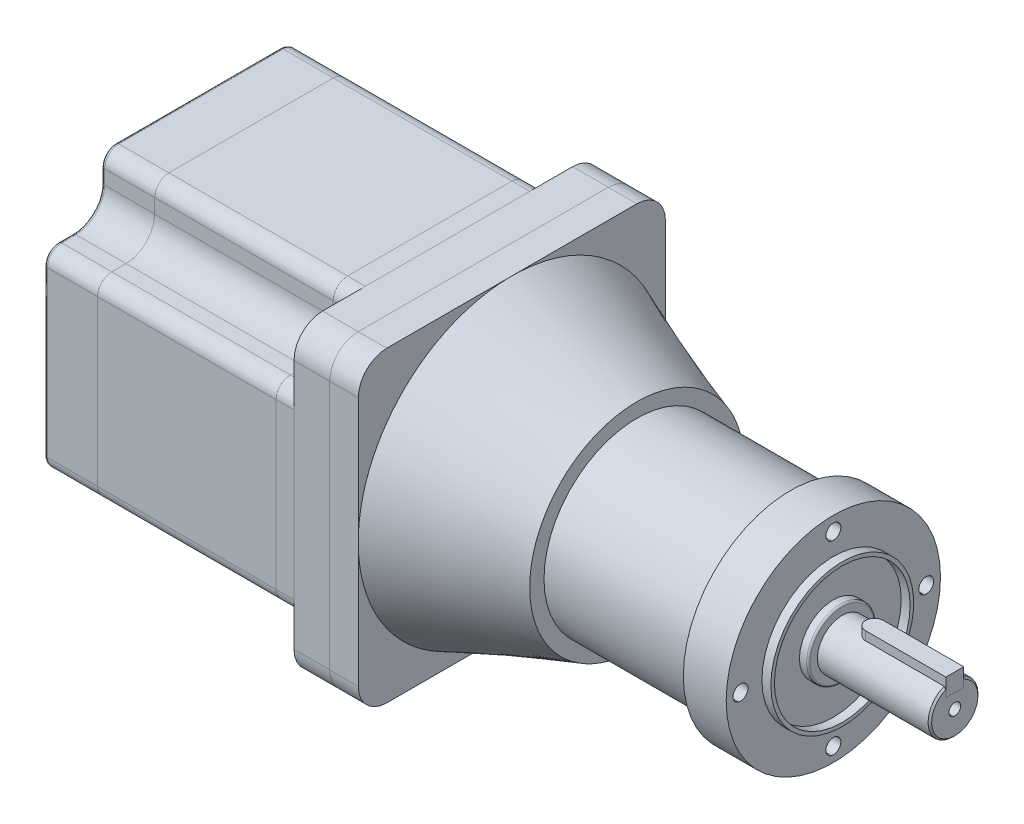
SolidWorks part; units mm, degrees
ref_plane "前视基准面" through (0, 0, 0) normal (0, 0, 1) x (1, 0, 0)
ref_plane "上视基准面" through (0, 0, 0) normal (0, 1, 0) x (1, 0, 0)
ref_plane "右视基准面" through (0, 0, 0) normal (1, 0, 0) x (0, 0, -1)
sketch "草图1" plane through (0, 0, 0) normal (1, 0, 0) x (0, 0, -1)
  line L1 (-35, -43) -> (35, -43)
  line L2 (-43, -35) -> (-43, 35)
  line L3 (-35, 43) -> (35, 43)
  line L4 (43, -35) -> (43, 35)
  line L5 (-43, -43) -> (43, 43) construction
  line L6 (-43, 43) -> (43, -43) construction
  arc A0 (-35, -43) -> (-43, -35) centre (-35, -35) cw
  arc A1 (43, -35) -> (35, -43) centre (35, -35) cw
  arc A2 (-35, 43) -> (-43, 35) centre (-35, 35) ccw
  arc A3 (35, 43) -> (43, 35) centre (35, 35) cw
  point P0 (0, 0)
  dimension "D1" = 8
extrude "凸台-拉伸1" add sketch "草图1" against normal blind 10
sketch "草图2" plane through (-10, 0, 0) normal (-1, 0, 0) x (0, 0, 1)
  line L0 (-35, 43) -> (35, 43) construction
  line L1 (-35, -43) -> (35, -43)
  line L2 (-43, -35) -> (-43, 35)
  line L3 (-35, 43) -> (35, 43)
  line L4 (43, -35) -> (43, 35)
  line L5 (-43, -43) -> (43, 43) construction
  line L6 (-43, 43) -> (43, -43) construction
  arc A0 (-43, -35) -> (-35, -43) centre (-35, -35) ccw
  arc A1 (35, -43) -> (43, -35) centre (35, -35) ccw
  arc A2 (43, 35) -> (35, 43) centre (35, 35) ccw
  arc A3 (-43, 35) -> (-35, 43) centre (-35, 35) cw
  point P0 (0, 0)
  dimension "D1" = 8
extrude "凸台-拉伸2" add sketch "草图2" along normal blind 5 separate body
sketch "草图3" plane through (-15, 0, 0) normal (-1, 0, 0) x (0, 0, 1)
  line L0 (35, 43) -> (-35, 43) construction
  line L1 (-35, -43) -> (35, -43)
  line L2 (-43, -35) -> (-43, 35)
  line L3 (-35, 43) -> (35, 43)
  line L4 (43, -35) -> (43, 35)
  line L5 (-43, -43) -> (43, 43) construction
  line L6 (-43, 43) -> (43, -43) construction
  arc A0 (-43, -35) -> (-35, -43) centre (-35, -35) ccw
  arc A1 (35, -43) -> (43, -35) centre (35, -35) ccw
  arc A2 (43, 35) -> (35, 43) centre (35, 35) ccw
  arc A3 (-43, 35) -> (-35, 43) centre (-35, 35) cw
  point P0 (0, 0)
  dimension "D1" = 8
extrude "凸台-拉伸3" add sketch "草图3" along normal blind 50 separate body
sketch "草图4" plane through (-65, 0, 0) normal (-1, 0, 0) x (0, 0, 1)
  line L0 (35, 43) -> (-35, 43) construction
  line L1 (-35, -43) -> (35, -43)
  line L2 (-43, -35) -> (-43, 35)
  line L3 (-35, 43) -> (35, 43)
  line L4 (43, -35) -> (43, 35)
  line L5 (-43, -43) -> (43, 43) construction
  line L6 (-43, 43) -> (43, -43) construction
  arc A0 (-43, -35) -> (-35, -43) centre (-35, -35) ccw
  arc A1 (35, -43) -> (43, -35) centre (35, -35) ccw
  arc A2 (43, 35) -> (35, 43) centre (35, 35) ccw
  arc A3 (-43, 35) -> (-35, 43) centre (-35, 35) cw
  point P0 (0, 0)
  dimension "D1" = 8
extrude "凸台-拉伸4" add sketch "草图4" along normal blind 15 separate body
sketch "草图5" plane through (-80, 0, 0) normal (-1, 0, 0) x (0, 0, 1)
  line L0 (-35, -27) -> (-39, -27)
  line L1 (-43, 35) -> (-43, -35) construction
  line L3 (-39, 27) -> (-35, 27)
  line L4 (-43, -35) -> (-43, -23)
  line L5 (-27, 35) -> (-27, 39)
  line L6 (35, 43) -> (-35, 43) construction
  line L8 (27, 39) -> (27, 35)
  line L9 (-35, -43) -> (-23, -43)
  line L10 (35, 27) -> (39, 27)
  line L12 (43, -35) -> (43, 35) construction
  line L13 (39, -27) -> (35, -27)
  line L14 (35, -43) -> (23, -43)
  line L15 (27, -35) -> (27, -39)
  line L16 (-35, -43) -> (35, -43) construction
  line L18 (-27, -39) -> (-27, -35)
  line L19 (43, -35) -> (43, -23)
  line L20 (43, 35) -> (43, 23)
  line L21 (35, 43) -> (23, 43)
  line L22 (-35, 43) -> (-23, 43)
  line L23 (-43, 35) -> (-43, 23)
  arc A0 (-35, 43) -> (-43, 35) centre (-35, 35) ccw
  arc A1 (27, 35) -> (35, 27) centre (35, 35) ccw
  arc A2 (35, -27) -> (27, -35) centre (35, -35) ccw
  arc A3 (-43, -35) -> (-35, -43) centre (-35, -35) ccw
  arc A4 (-39, -27) -> (-43, -23) centre (-39, -23) cw
  arc A5 (-43, 23) -> (-39, 27) centre (-39, 23) cw
  arc A6 (-23, 43) -> (-27, 39) centre (-23, 39) ccw
  arc A7 (23, 43) -> (27, 39) centre (23, 39) cw
  arc A8 (43, 23) -> (39, 27) centre (39, 23) ccw
  arc A9 (43, -23) -> (39, -27) centre (39, -23) cw
  arc A10 (27, -39) -> (23, -43) centre (23, -39) cw
  arc A11 (-27, -39) -> (-23, -43) centre (-23, -39) ccw
  arc A12 (-27, -35) -> (-35, -27) centre (-35, -35) ccw
  arc A13 (-35, 27) -> (-27, 35) centre (-35, 35) ccw
  arc A14 (43, 35) -> (35, 43) centre (35, 35) ccw
  arc A15 (35, -43) -> (43, -35) centre (35, -35) ccw
  point P38 (-43, -27)
  point P41 (-43, 27)
  point P44 (-27, 43)
  point P47 (27, 43)
  point P52 (43, -27)
  point P55 (27, -43)
  point P58 (-27, -43)
  dimension "D1" = 4
extrude "切除-拉伸1" cut sketch "草图5" against normal blind 70
sketch "草图6" plane through (0, 0, 0) normal (1, 0, 0) x (0, 0, -1)
  line L0 (43, -35) -> (43, 35) construction
  line L1 (-35, 43) -> (35, 43)
  line L2 (-43, 35) -> (-43, -35)
  line L3 (-35, -43) -> (35, -43)
  line L4 (43, 35) -> (43, -35)
  line L5 (-43, 43) -> (43, -43) construction
  line L6 (-43, -43) -> (43, 43) construction
  arc A0 (-35, 43) -> (-43, 35) centre (-35, 35) ccw
  arc A1 (-43, -35) -> (-35, -43) centre (-35, -35) ccw
  arc A2 (35, -43) -> (43, -35) centre (35, -35) ccw
  arc A3 (35, 43) -> (43, 35) centre (35, 35) cw
  point P0 (0, 0)
  dimension "D1" = 8
extrude "凸台-拉伸5" add sketch "草图6" along normal blind 8 separate body
sketch "草图7" plane through (8, 0, 0) normal (1, 0, 0) x (0, 0, -1)
  circle A0 centre (0, 0) radius 43
ref_plane "基准面1" through (43, 0, 0) normal (1, 0, 0) x (0, 0, -1)
sketch "草图8" plane through (43, 0, 0) normal (1, 0, 0) x (0, 0, -1)
  circle A0 centre (0, 0) radius 30
loft "放样1" add profiles "草图8", "草图7"
sketch "草图9" plane through (43, 0, 0) normal (1, 0, 0) x (0, 0, -1)
  circle A0 centre (0, 0) radius 26
extrude "凸台-拉伸6" add sketch "草图9" along normal blind 43 separate body
sketch "草图10" plane through (86, 0, 0) normal (1, 0, 0) x (0, 0, -1)
  circle A0 centre (0, 0) radius 30
extrude "凸台-拉伸7" add sketch "草图10" along normal blind 12 separate body
sketch "草图11" plane through (98, 0, 0) normal (1, 0, 0) x (0, 0, -1)
  circle A0 centre (0, 0) radius 20
extrude "凸台-拉伸8" add sketch "草图11" along normal blind 2.5 separate body
sketch "草图12" plane through (98, 0, 0) normal (1, 0, 0) x (0, 0, -1)
  point P7 (0, 26)
  point P8 (-26, 0)
  point P9 (0, -26)
  point P10 (26, 0)
sketch "草图17" plane through (100.5, 0, 0) normal (1, 0, 0) x (0, 0, -1)
  circle A0 centre (0, 0) radius 7
extrude "凸台-拉伸9" add sketch "草图17" along normal blind 31.5 separate body
ref_plane "基准面2" through (0, 7, 0) normal (0, 1, 0) x (1, 0, 0)
chamfer "倒角3" distance 0.5 angle 45 1 edges at (132, 0, -7)
sketch "草图21" plane through (132, 0, 0) normal (1, 0, 0) x (0, 0, -1)
  point P0 (0, 0)
hole_wizard "M4 螺纹孔1" positions "3D草图5" profile "草图22" tap size "M4" standard "GB"
sketch3d "3D草图5"
  point P0 (132, 0, 0)
sketch "草图22" plane through (132, 0, 0) normal (0, 1, 0) x (0, 0, -1)
  line L0 (0, 0) -> (0, 12.4914)
  line L1 (0, 12.4914) -> (1.65, 11.5)
  line L2 (1.65, 11.5) -> (1.65, 0)
  line L5 (1.65, 0) -> (0, 0)
  line L10 (0, 12.4914) -> (-1.65, 11.5) construction
  line L11 (0, -6.35) -> (0, 107.95) construction
  dimension "螺纹孔钻头直径" = 3.3
  dimension "螺纹孔钻头深度" = 11.5
  dimension "导头角度" = 118
sketch "草图23" plane through (-10, 0, 0) normal (-1, 0, 0) x (0, 0, 1)
  circle A0 centre (-35, 35) radius 3.9972
  circle A1 centre (35, 35) radius 4
  circle A2 centre (35, -35) radius 4
  circle A3 centre (-35, -35) radius 4
extrude "凸台-拉伸11" add sketch "草图23" along normal blind 3 separate body
chamfer "倒角4" distance 0.3 angle 45 1 edges at (-13, 35, -31.0028)
chamfer "倒角5" distance 0.3 angle 45 1 edges at (-13, -35, -31)
chamfer "倒角6" distance 0.3 angle 45 1 edges at (-13, 35, 39)
chamfer "倒角7" distance 0.3 angle 45 1 edges at (-13, -35, 39)
sketch "草图24" plane through (-13, 0, 0) normal (-1, 0, 0) x (0, 0, 1)
  line L1 (-33.701, 37.25) -> (-36.299, 37.25)
  line L2 (-36.299, 37.25) -> (-37.5981, 35)
  line L3 (-37.5981, 35) -> (-36.299, 32.75)
  line L4 (-36.299, 32.75) -> (-33.701, 32.75)
  line L5 (-33.701, 32.75) -> (-32.4019, 35)
  line L6 (-32.4019, 35) -> (-33.701, 37.25)
  line L7 (33.701, 32.75) -> (36.299, 32.75)
  line L8 (36.299, 32.75) -> (37.5981, 35)
  line L9 (37.5981, 35) -> (36.299, 37.25)
  line L10 (36.299, 37.25) -> (33.701, 37.25)
  line L11 (33.701, 37.25) -> (32.4019, 35)
  line L12 (32.4019, 35) -> (33.701, 32.75)
  line L13 (33.701, -37.25) -> (36.299, -37.25)
  line L14 (36.299, -37.25) -> (37.5981, -35)
  line L15 (37.5981, -35) -> (36.299, -32.75)
  line L16 (36.299, -32.75) -> (33.701, -32.75)
  line L17 (33.701, -32.75) -> (32.4019, -35)
  line L18 (32.4019, -35) -> (33.701, -37.25)
  line L19 (-33.701, -32.75) -> (-36.299, -32.75)
  line L20 (-36.299, -32.75) -> (-37.5981, -35)
  line L21 (-37.5981, -35) -> (-36.299, -37.25)
  line L22 (-36.299, -37.25) -> (-33.701, -37.25)
  line L23 (-33.701, -37.25) -> (-32.4019, -35)
  line L24 (-32.4019, -35) -> (-33.701, -32.75)
  circle A0 centre (-35, 35) radius 2.25 construction
  circle A1 centre (35, 35) radius 2.25 construction
  circle A2 centre (35, -35) radius 2.25 construction
  circle A3 centre (-35, -35) radius 2.25 construction
extrude "切除-拉伸3" cut sketch "草图24" against normal blind 1
chamfer "倒角8" distance 0.1 angle 45 6 edges at (-12, -37.25, -35) (-12, -36.125, -36.9486) (-13, -36.125, -33.0514) (-13, -33.875, -33.0514) (-13, -33.875, -36.9486) (-13, -32.75, -35)
chamfer "倒角9" distance 0.1 angle 45 6 edges at (-13, -33.875, 36.9486) (-13, -36.125, 36.9486) (-13, -37.25, 35) (-13, -36.125, 33.0514) (-13, -33.875, 33.0514) (-13, -32.75, 35)
chamfer "倒角10" distance 0.1 angle 45 6 edges at (-13, 37.25, 35) (-13, 36.125, 36.9486) (-13, 33.875, 36.9486) (-13, 32.75, 35) (-13, 33.875, 33.0514) (-13, 36.125, 33.0514)
chamfer "倒角11" distance 0.1 angle 45 6 edges at (-13, 33.875, -36.9486) (-13, 32.75, -35) (-13, 33.875, -33.0514) (-13, 36.125, -33.0514) (-13, 36.125, -36.9486) (-13, 37.25, -35)
sketch "草图25" plane through (100.5, 0, 0) normal (1, 0, 0) x (0, 0, -1)
  circle A0 centre (0, 0) radius 19
extrude "切除-拉伸4" cut sketch "草图25" against normal blind 2.5
sketch "草图26" plane through (98, 0, 0) normal (1, 0, 0) x (0, 0, -1)
  circle A0 centre (0, 0) radius 9.5
extrude "凸台-拉伸12" add sketch "草图26" along normal blind 2.5
fillet "圆角1" radius 0.5 1 edges at (100.5, 0, -9.5)
fillet "圆角2" radius 1 24 edges at (-80, -37, -27) (-80, -29.3431, -29.3431) (-80, -27, -37) (-80, -25.8284, -41.8284) (-80, 0, -43) (-80, 25.8284, -41.8284) (-80, 27, -37) (-80, 29.3431, -29.3431) (-80, 37, -27) (-80, 41.8284, -25.8284) (-80, 43, 0) (-80, 41.8284, 25.8284) (-80, 37, 27) (-80, 29.3431, 29.3431) (-80, 27, 37) (-80, 25.8284, 41.8284) (-80, 0, 43) (-80, -25.8284, 41.8284) (-80, -27, 37) (-80, -29.3431, 29.3431) (-80, -37, 27) (-80, -41.8284, 25.8284) (-80, -43, 0) (-80, -41.8284, -25.8284)
hole_wizard "M5 螺纹孔1" positions "3D草图7" profile "草图29" tap size "M5" standard "GB"
sketch3d "3D草图7"
  point P0 (98, 26, 0)
  point P3 (98, 0, 26)
  point P6 (98, -26, 0)
  point P9 (98, 0, -26)
sketch "草图29" plane through (98, 26, 0) normal (0, 1, 0) x (0, 0, -1)
  line L0 (0, 0) -> (0, 11.2618)
  line L1 (0, 11.2618) -> (2.1, 10)
  line L2 (2.1, 10) -> (2.1, 0)
  line L5 (2.1, 0) -> (0, 0)
  line L10 (0, 11.2618) -> (-2.1, 10) construction
  line L11 (0, -6.35) -> (0, 107.95) construction
  dimension "螺纹孔钻头直径" = 4.2
  dimension "螺纹孔钻头深度" = 10
  dimension "导头角度" = 118
sketch "草图40" plane through (0, 7, 0) normal (0, 1, 0) x (1, 0, 0)
  line L1 (132, -6.5) -> (132, 6.5) construction
  line L2 (109.5, 2.5) -> (132, 2.5)
  line L3 (132, 2.5) -> (132, -2.5)
  line L4 (132, -2.5) -> (109.5, -2.5)
  arc A0 (109.5, 2.5) -> (109.5, -2.5) centre (109.5, 0) ccw
extrude "切除-拉伸6" cut sketch "草图40" against normal blind 3
sketch "草图41" plane through (0, 4, 0) normal (0, 1, 0) x (1, 0, 0)
  line L0 (109.5, 2.5) -> (132, 2.5)
  line L1 (132, 2.5) -> (132, -2.5)
  line L2 (132, -2.5) -> (109.5, -2.5)
  arc A0 (109.5, 2.5) -> (109.5, -2.5) centre (109.5, 0) ccw
extrude "凸台-拉伸14" add sketch "草图41" along normal blind 5 separate body
